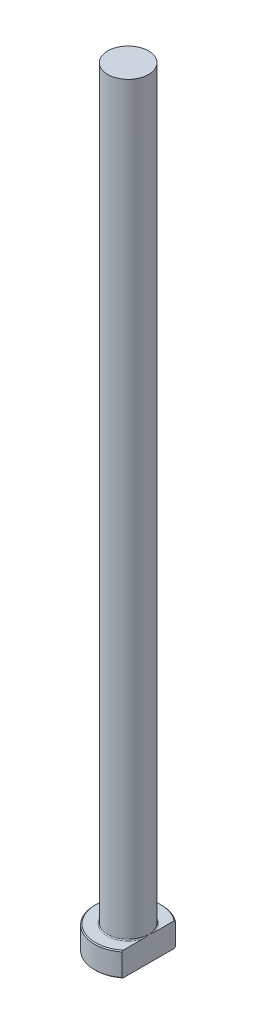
SolidWorks part; units mm, degrees
ref_plane "Front Plane" through (0, 0, 0) normal (0, 0, 1) x (1, 0, 0)
ref_plane "Top Plane" through (0, 0, 0) normal (0, 1, 0) x (1, 0, 0)
ref_plane "Right Plane" through (0, 0, 0) normal (1, 0, 0) x (0, 0, -1)
sketch "Sketch1" plane through (0, 0, 0) normal (0, 0, 1) x (1, 0, 0)
  line L0 (0, 259.9588) -> (0, -15.1925) construction
  line L1 (0, 0) -> (-7, 0)
  line L2 (-7, 0) -> (-7, 5)
  line L3 (-7, 5) -> (-4.25, 5)
  line L4 (-4.25, 5) -> (-4.25, 160)
  line L5 (-4.25, 160) -> (0, 160)
  line L6 (0, 160) -> (0, 0)
  dimension "L" = 160
  dimension "H" = 14
  dimension "T" = 5
  dimension "D" = 8.5
revolve "Revolve1" add sketch "Sketch1" angle 360 about L0
chamfer "Chamfer1" distance 0.2 angle 45 2 edges at (0, 5, 7) (0, 0, 7)
fillet "Fillet1" radius 0.2 1 edges at (0, 5, 4.25)
sketch "Sketch2" plane through (0, 0, 0) normal (0, 1, 0) x (1, 0, 0)
  line L0 (4.25, 5.5621) -> (4.25, -5.5621)
  circle A0 centre (0, 0) radius 7 construction
  arc A1 (4.25, -5.5621) -> (4.25, 5.5621) centre (0, 0) ccw
  circle A2 centre (0, 0) radius 4.25 construction
extrude "KEY" cut sketch "Sketch2" along normal through all
